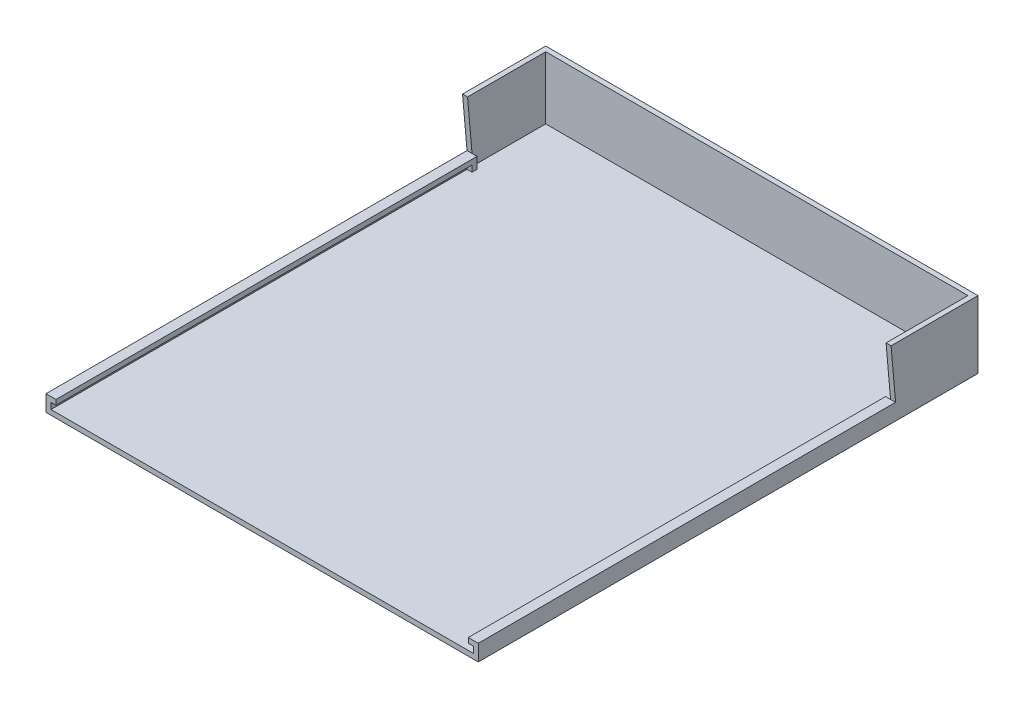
SolidWorks part; units mm, degrees
ref_plane "Front Plane" through (0, 0, 0) normal (0, 0, 1) x (1, 0, 0)
ref_plane "Top Plane" through (0, 0, 0) normal (0, 1, 0) x (1, 0, 0)
ref_plane "Right Plane" through (0, 0, 0) normal (1, 0, 0) x (0, 0, -1)
sketch "Sketch1" plane through (0, 0, 0) normal (0, 1, 0) x (1, 0, 0)
  line L1 (-86.5, 100) -> (86.5, 100)
  line L2 (-86.5, 100) -> (-86.5, -100)
  line L3 (-86.5, -100) -> (86.5, -100)
  line L4 (86.5, 100) -> (86.5, -100)
  line L5 (-86.5, 100) -> (86.5, -100) construction
  line L6 (-86.5, -100) -> (86.5, 100) construction
  point P0 (0, 0)
  dimension "D1" = 173
  dimension "D2" = 200
extrude "Boss-Extrude1" add sketch "Sketch1" along normal blind 2 contours L2 L3 L4 L1
sketch "Sketch2" plane through (0, 2, 0) normal (0, 1, 0) x (1, 0, 0)
  line L0 (-86.5, -100) -> (-84.5, -100)
  line L1 (-86.5, -100) -> (86.5, -100) construction
  line L2 (-84.5, -100) -> (84.5, -100) construction
  line L3 (84.5, -100) -> (86.5, -100)
  line L4 (-86.5, 100) -> (-84.5, 100)
  line L5 (-84.5, 100) -> (84.5, 100) construction
  line L6 (84.5, 100) -> (86.5, 100)
  line L7 (-86.5, 100) -> (-86.5, -100)
  line L8 (-84.5, 100) -> (-84.5, -100)
  line L9 (84.5, 100) -> (84.5, -100)
  line L10 (86.5, 100) -> (86.5, -100)
  dimension "D1" = 2
  dimension "D2" = 2
extrude "Boss-Extrude2" add sketch "Sketch2" along normal blind 4.5
sketch "Sketch3" plane through (-84.5, 0, 0) normal (1, 0, 0) x (0, 0, -1)
  line L0 (100, 6.5) -> (100, 2) construction
  line L1 (-100, 6.5) -> (100, 6.5)
  line L2 (-100, 6.5) -> (-100, 4.5)
  line L3 (-100, 4.5) -> (100, 4.5)
  line L4 (100, 6.5) -> (100, 4.5)
  dimension "D1" = 2
extrude "Boss-Extrude3" add sketch "Sketch3" along normal blind 2
sketch "Sketch4" plane through (84.5, 0, 0) normal (-1, 0, 0) x (0, 0, 1)
  line L0 (100, 6.5) -> (100, 2) construction
  line L1 (-100, 6.5) -> (100, 6.5)
  line L2 (-100, 6.5) -> (-100, 4.5)
  line L3 (-100, 4.5) -> (100, 4.5)
  line L4 (100, 6.5) -> (100, 4.5)
  dimension "D1" = 2
extrude "Boss-Extrude4" add sketch "Sketch4" along normal blind 2
sketch "Sketch5" plane through (0, 6.5, 0) normal (0, 1, 0) x (1, 0, 0)
  line L0 (86.5, -100) -> (86.5, 66.5) construction
  line L1 (86.5, -100) -> (86.5, 100) construction
  line L3 (86.5, 66.5) -> (-86.5, 66.5)
  line L4 (86.5, 66.5) -> (86.5, 100)
  line L5 (86.5, 100) -> (-86.5, 100)
  line L6 (-86.5, 66.5) -> (-86.5, 100)
  dimension "D1" = 166.5
extrude "Cut-Extrude1" cut sketch "Sketch5" against normal blind 4.5
sketch "Sketch6" plane through (0, 2, 0) normal (0, 1, 0) x (1, 0, 0)
  line L0 (82.5, 66.5) -> (86.5, 66.5)
  line L1 (-86.5, 66.5) -> (-82.5, 66.5)
  line L2 (-86.5, 66.5) -> (-86.5, 68.5)
  line L3 (-86.5, 68.5) -> (-82.5, 68.5)
  line L4 (-82.5, 66.5) -> (-82.5, 68.5)
  line L5 (82.5, 66.5) -> (82.5, 67)
  line L6 (82.5, 67) -> (86.5, 67)
  line L7 (86.5, 66.5) -> (86.5, 67)
  point P5 (0, 0)
  point P11 (0, 0)
  point P12 (0, 0)
  dimension "D1" = 2
extrude "Boss-Extrude5" add sketch "Sketch6" along normal blind 4.5
sketch "Sketch7" plane through (0, 2, 0) normal (0, 1, 0) x (1, 0, 0)
  line L0 (-86.5, 98) -> (-86.5, 100)
  line L10 (-84.5, 98) -> (-84.5, 68.5)
  line L11 (-84.5, 68.5) -> (-86.5, 68.5)
  line L12 (-86.5, 98) -> (-86.5, 68.5)
  line L13 (86.5, 67) -> (84.5, 67)
  line L14 (86.5, 67) -> (86.5, 98)
  line L16 (84.5, 67) -> (84.5, 98)
  line L17 (-86.5, 100) -> (86.5, 100)
  line L18 (86.5, 100) -> (86.5, 98)
  line L19 (84.5, 98) -> (-84.5, 98)
  dimension "D1" = 2
  dimension "D3" = 2
extrude "Boss-Extrude6" add sketch "Sketch7" along normal blind 25 contours L19 L10 L11 L12 L0 L17 L18 L14 L13 L16
sketch "Sketch8" plane through (-86.5, 0, 0) normal (-1, 0, 0) x (0, 0, 1)
  line L0 (-68.5, 6.5) -> (-68.5, 27)
  line L1 (-68.5, 27) -> (-66.7065, 27)
  line L2 (-66.7065, 27) -> (-68.5, 6.5)
  dimension "D1" = 5
extrude "Boss-Extrude7" add sketch "Sketch8" against normal blind 2
sketch "Sketch9" plane through (86.5, 0, 0) normal (1, 0, 0) x (0, 0, -1)
  line L0 (67, 6.5) -> (67, 27)
  line L3 (65.2065, 27) -> (67, 6.5)
  line L4 (67, 27) -> (65.2065, 27)
  point P2 (0, 0)
extrude "Boss-Extrude8" add sketch "Sketch9" against normal blind 2
